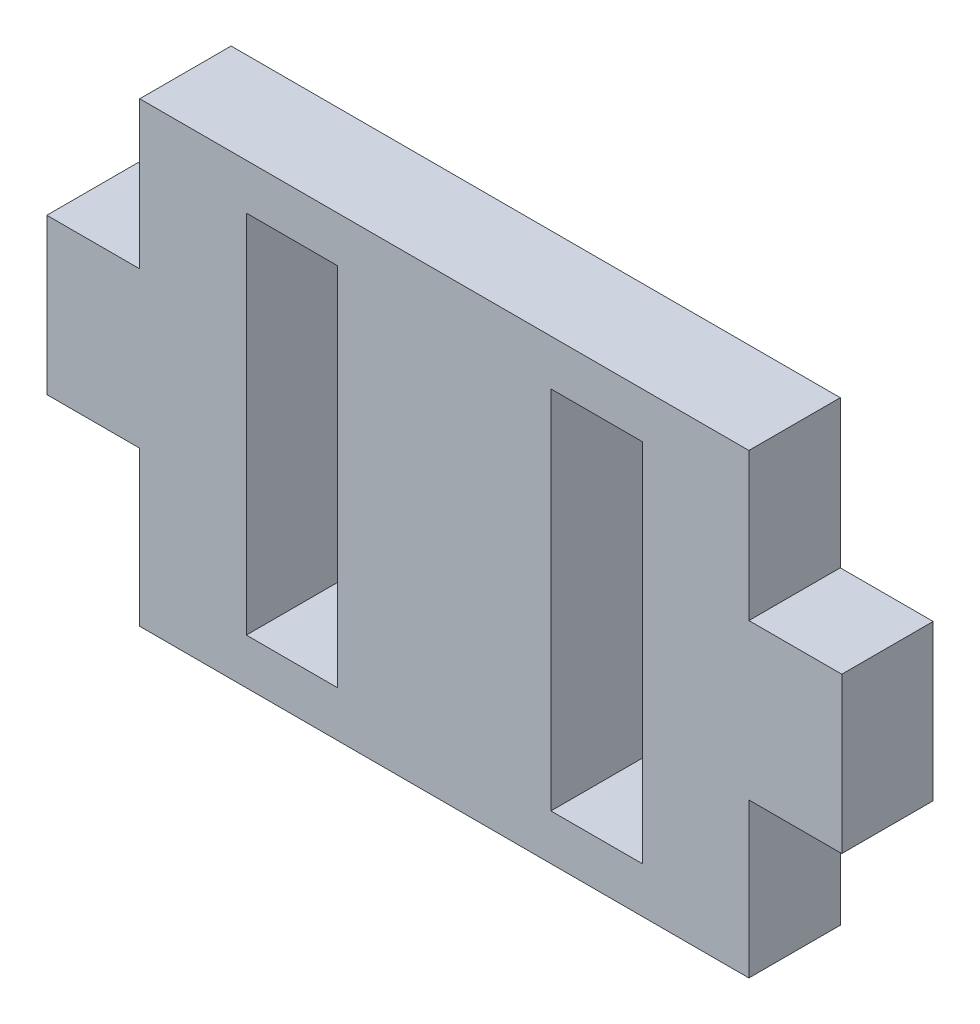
SolidWorks part; units mm, degrees
ref_plane "Front Plane" through (0, 0, 0) normal (0, 0, 1) x (1, 0, 0)
ref_plane "Top Plane" through (0, 0, 0) normal (0, 1, 0) x (1, 0, 0)
ref_plane "Right Plane" through (0, 0, 0) normal (1, 0, 0) x (0, 0, -1)
sketch "Sketch1" plane through (0, 0, 0) normal (0, 0, 1) x (1, 0, 0)
  line L0 (-5.9099, 2.3702) -> (-12.0099, 2.3702)
  line L1 (-5.9099, 12.044) -> (34.0901, 12.044)
  line L2 (-5.9099, 12.044) -> (-5.9099, 2.3702)
  line L3 (-5.9099, -17.956) -> (34.0901, -17.956)
  line L4 (34.0901, 12.044) -> (34.0901, 2.3702)
  line L5 (-12.0099, 2.3702) -> (-12.0099, -7.8298)
  line L6 (-12.0099, -7.8298) -> (-5.9099, -7.8298)
  line L7 (-5.9099, -7.8298) -> (-5.9099, -17.956)
  line L8 (14.0901, 12.044) -> (14.0901, -17.956) construction
  line L9 (27.0901, -14.956) -> (21.0901, -14.956)
  line L10 (1.0901, 9.044) -> (7.0901, 9.044)
  line L11 (1.0901, 9.044) -> (1.0901, -14.956)
  line L12 (1.0901, -14.956) -> (7.0901, -14.956)
  line L13 (7.0901, 9.044) -> (7.0901, -14.956)
  line L14 (21.0901, 9.044) -> (21.0901, -14.956)
  line L15 (27.0901, 9.044) -> (27.0901, -14.956)
  line L16 (27.0901, 9.044) -> (21.0901, 9.044)
  line L17 (40.1901, -7.8298) -> (34.0901, -7.8298)
  line L18 (40.1901, 2.3702) -> (40.1901, -7.8298)
  line L19 (34.0901, 2.3702) -> (40.1901, 2.3702)
  line L20 (34.0901, -7.8298) -> (34.0901, -17.956)
  point P15 (4.0901, 9.044)
extrude "Boss-Extrude1" add sketch "Sketch1" along normal blind 6
equation "\"HeightHouse\" = 200mm"
equation "\"LenghtHouse\"= 300mm"
equation "\"WidthHouse\"= 230mm"
equation "\"ThicknessMaterial\"= 6mm"
equation "\"Kerf\"= 0.1mm"
equation "\"WidthWindows\"= 45mm"
equation "\"WidthDoor\"= 60mm"
equation "\"HeightDoor\"= 80mm"
equation "\"LenghtJoints\" = 30mm"
equation "\"HeightWindows\"= 60"
equation "\"DistanceForJointsRoof\"= 50mm"
equation "\"Roof1\"= 115mm"
equation "\"Roof2\"= 140mm"
equation "\"WidthWindowFrame\"= 3mm"
equation "\"DistanceForJointsBody\"= 35mm"
equation "\"CornerRoofBig\"= 70deg"
equation "\"CornerRoofSmall\"= 60deg"
equation "\"LenghtRoof\"=\"LenghtHouse\"+40mm"
equation "\"RoofSmall\"=120mm"
equation "\"RoofBig\"=170mm"
equation "\"TerraceLenght\"= \"WidthWindows\"+35mm"
equation "\"TerraceHeight\"= \"HeightWindows\"/2"
equation "\"LenghtJointTerrace\"=10mm"
equation "\"DistanceJointForChimney\"=10mm"
equation "\"HeightChimney\"=35mm"
equation "\"WidthChimney\"=20mm"
equation "\"D1@Sketch1\"=\"TerraceWidth\""
equation "\"D2@Sketch1\"=\"LenghtJointTerrace\"+\"Kerf\"*2"
equation "\"D3@Sketch1\"=\"ThicknessMaterial\"+\"Kerf\""
equation "\"TerraceWidth\"= \"TerraceHeight\"+10mm"
equation "\"D4@Sketch1\"=\"TerraceHeight\""
equation "\"D5@Sketch1\"=\"WidthWindowFrame\"*2"
equation "\"D6@Sketch1\"=\"WidthWindowFrame\""
equation "\"D7@Sketch1\"=\"WidthWindowFrame\""
equation "\"D8@Sketch1\"=\"TerraceWidth\"/4"
equation "\"D1@Boss-Extrude1\"=\"ThicknessMaterial\""
